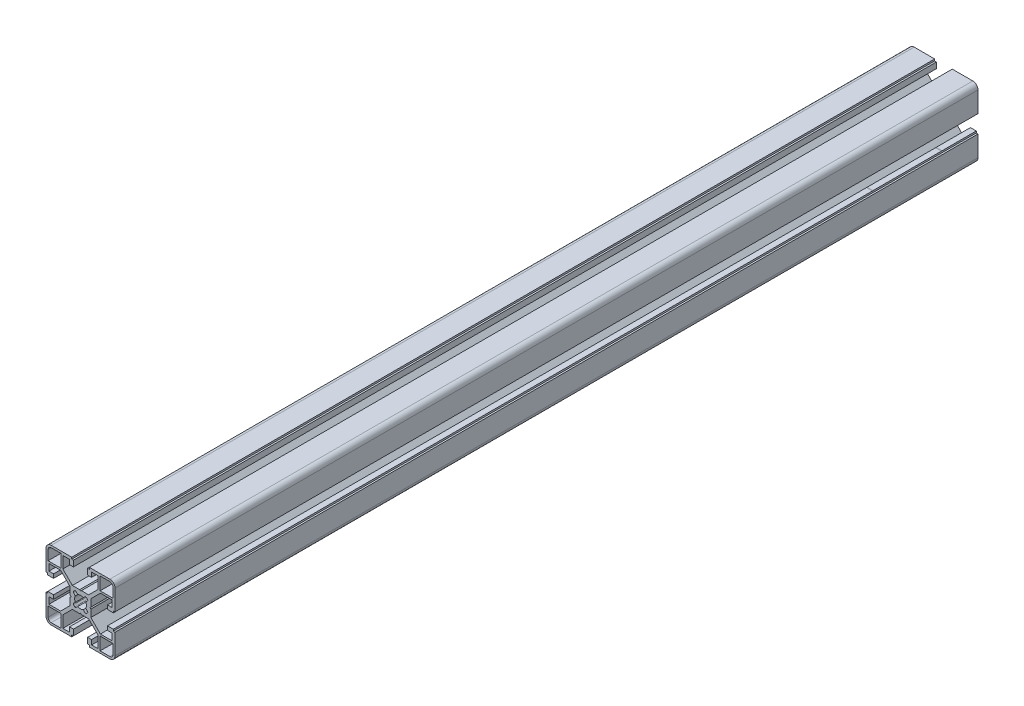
SolidWorks part; units mm, degrees
ref_plane "Спереди" through (0, 0, 0) normal (0, 0, 1) x (1, 0, 0)
ref_plane "Сверху" through (0, 0, 0) normal (0, 1, 0) x (1, 0, 0)
ref_plane "Справа" through (0, 0, 0) normal (1, 0, 0) x (0, 0, -1)
sketch "Эскиз1" plane through (0, 0, 0) normal (0, 0, 1) x (1, 0, 0)
  line L0 (2.2605, 2.8746) -> (1.1995, 1.8136)
  line L1 (-1.9819, 1.8136) -> (-3.0428, 2.8746)
  line L2 (-3.75, 2.8746) -> (-4.4571, 2.1675)
  line L3 (-4.4571, 1.4603) -> (-3.3961, 0.3994)
  line L4 (-3.3961, -2.782) -> (-4.4571, -3.843)
  line L5 (-4.4571, -4.5501) -> (-3.75, -5.2572)
  line L6 (-3.0428, -5.2572) -> (-1.9819, -4.1962)
  line L7 (1.1995, -4.1962) -> (2.2605, -5.2572)
  line L8 (2.9676, -5.2572) -> (3.6747, -4.5501)
  line L9 (3.6747, -3.843) -> (2.6137, -2.782)
  line L10 (2.6137, 0.3994) -> (3.6747, 1.4603)
  line L11 (3.6747, 2.1675) -> (2.9676, 2.8746)
  line L12 (10.9608, 17.6126) -> (10.9608, 10.1567)
  line L13 (10.9608, 10.1567) -> (18.4088, 10.1567)
  line L14 (18.4088, 10.1567) -> (18.4088, 15.8126)
  line L15 (16.6088, 17.6126) -> (10.9608, 17.6126)
  line L16 (-19.1912, 15.8126) -> (-19.1912, 10.1607)
  line L17 (-19.1912, 10.1607) -> (-11.7392, 10.1607)
  line L18 (-11.7392, 10.1607) -> (-11.7392, 17.6126)
  line L19 (-11.7412, -19.9874) -> (-11.7412, -12.5374)
  line L20 (-11.7412, -12.5374) -> (-19.1912, -12.5374)
  line L21 (-19.1912, -12.5374) -> (-19.1912, -18.1874)
  line L22 (-17.3912, -19.9874) -> (-11.7412, -19.9874)
  line L23 (18.4088, -12.5433) -> (10.9568, -12.5433)
  line L24 (10.9568, -12.5433) -> (10.9568, -19.9874)
  line L25 (10.9568, -19.9874) -> (16.6088, -19.9874)
  line L26 (18.4088, -18.1874) -> (18.4088, -12.5433)
  line L27 (-11.7392, 17.6126) -> (-17.3912, 17.6126)
  line L28 (-0.899, 4.8087) -> (-5.1283, 4.8087)
  line L29 (-5.1283, 4.8087) -> (-10.6438, 10.3271)
  line L30 (-10.6438, 10.3271) -> (-10.6438, 17.1126)
  line L31 (-10.6438, 17.1126) -> (-6.7958, 17.1126)
  line L32 (-6.7958, 17.1126) -> (-6.7958, 14.4126)
  line L33 (-6.7958, 14.4126) -> (-4.4958, 14.4126)
  line L34 (-4.4958, 14.4126) -> (-4.4958, 17.8126)
  line L35 (-4.4958, 17.8126) -> (-5.4958, 17.8126)
  line L36 (-5.4958, 17.8126) -> (-5.4958, 18.8126)
  line L37 (-5.4958, 18.8126) -> (-17.3958, 18.8126)
  line L38 (-20.3958, 15.8126) -> (-20.3958, 3.9126)
  line L39 (-20.3958, 3.9126) -> (-19.3958, 3.9126)
  line L40 (-19.3958, 3.9126) -> (-19.3958, 2.9126)
  line L41 (-19.3958, 2.9126) -> (-15.9958, 2.9126)
  line L42 (-15.9958, 2.9126) -> (-15.9958, 5.2053)
  line L43 (-15.9958, 5.2053) -> (-18.6958, 5.2053)
  line L44 (-18.6958, 5.2053) -> (-18.6958, 9.0533)
  line L45 (-18.6958, 9.0533) -> (-11.9226, 9.0533)
  line L46 (-11.9226, 9.0533) -> (-6.3958, 3.5271)
  line L47 (-6.3958, 3.5271) -> (-6.3958, -0.6905)
  line L48 (-6.3958, -0.6905) -> (-5.8949, -1.1914)
  line L49 (-5.8949, -1.1914) -> (-6.3958, -1.6923)
  line L50 (-6.3958, -1.6923) -> (-6.3958, -5.9099)
  line L51 (-6.3958, -5.9099) -> (-11.9233, -11.4374)
  line L52 (-11.9233, -11.4374) -> (-18.6958, -11.4374)
  line L53 (-18.6958, -11.4374) -> (-18.6958, -7.5874)
  line L54 (-18.6958, -7.5874) -> (-15.9958, -7.5874)
  line L55 (-15.9958, -7.5874) -> (-15.9958, -5.2874)
  line L56 (-15.9958, -5.2874) -> (-19.3958, -5.2874)
  line L57 (-19.3958, -5.2874) -> (-19.3958, -6.2874)
  line L58 (-19.3958, -6.2874) -> (-20.3958, -6.2874)
  line L59 (-20.3958, -6.2874) -> (-20.3958, -18.1874)
  line L60 (-17.3958, -21.1874) -> (-5.4958, -21.1874)
  line L61 (-5.4958, -21.1874) -> (-5.4958, -20.1874)
  line L62 (-5.4958, -20.1874) -> (-4.4958, -20.1874)
  line L63 (-4.4958, -20.1874) -> (-4.4958, -16.7874)
  line L64 (-4.4958, -16.7874) -> (-6.7958, -16.7874)
  line L65 (-6.7958, -16.7874) -> (-6.7958, -19.4874)
  line L66 (-6.7958, -19.4874) -> (-10.6458, -19.4874)
  line L67 (-10.6458, -19.4874) -> (-10.6458, -12.684)
  line L68 (-10.6458, -12.684) -> (-5.1336, -7.1913)
  line L69 (-5.1336, -7.1913) -> (-0.9023, -7.1913)
  line L70 (-0.9023, -7.1913) -> (-0.4037, -6.6927)
  line L71 (-0.4037, -6.6927) -> (0.0949, -7.1913)
  line L72 (0.0949, -7.1913) -> (4.3262, -7.1913)
  line L73 (4.3262, -7.1913) -> (9.8493, -12.7098)
  line L74 (9.8493, -12.7098) -> (9.8493, -19.4874)
  line L75 (9.8493, -19.4874) -> (6.0042, -19.4874)
  line L76 (6.0042, -19.4874) -> (6.0042, -16.7874)
  line L77 (6.0042, -16.7874) -> (3.7042, -16.7874)
  line L78 (3.7042, -16.7874) -> (3.7042, -20.1874)
  line L79 (3.7042, -20.1874) -> (4.7042, -20.1874)
  line L80 (4.7042, -20.1874) -> (4.7042, -21.1874)
  line L81 (4.7042, -21.1874) -> (16.6042, -21.1874)
  line L82 (19.6042, -18.1874) -> (19.6042, -6.2874)
  line L83 (19.6042, -6.2874) -> (18.599, -6.2874)
  line L84 (18.599, -6.2874) -> (18.599, -5.2874)
  line L85 (18.599, -5.2874) -> (15.199, -5.2874)
  line L86 (15.199, -5.2874) -> (15.199, -7.5874)
  line L87 (15.199, -7.5874) -> (17.899, -7.5874)
  line L88 (17.899, -7.5874) -> (17.899, -11.4433)
  line L89 (17.899, -11.4433) -> (11.1226, -11.4433)
  line L90 (11.1226, -11.4433) -> (5.599, -5.9193)
  line L91 (5.599, -5.9193) -> (5.599, -1.6815)
  line L92 (5.599, -1.6815) -> (5.1078, -1.1903)
  line L93 (5.1078, -1.1903) -> (5.599, -0.6991)
  line L94 (5.599, -0.6991) -> (5.599, 3.5388)
  line L95 (5.599, 3.5388) -> (11.1214, 9.0588)
  line L96 (11.1214, 9.0588) -> (17.899, 9.0588)
  line L97 (17.899, 9.0588) -> (17.899, 5.2147)
  line L98 (17.899, 5.2147) -> (15.199, 5.2147)
  line L99 (15.199, 5.2147) -> (15.199, 2.9147)
  line L100 (15.199, 2.9147) -> (18.599, 2.9147)
  line L101 (18.599, 2.9147) -> (18.599, 3.9147)
  line L102 (18.599, 3.9147) -> (19.6042, 3.9147)
  line L103 (19.6042, 3.9147) -> (19.6042, 15.8126)
  line L104 (16.6042, 18.8126) -> (4.7042, 18.8126)
  line L105 (4.7042, 18.8126) -> (4.7042, 17.8126)
  line L106 (4.7042, 17.8126) -> (3.7042, 17.8126)
  line L107 (3.7042, 17.8126) -> (3.7042, 14.4126)
  line L108 (3.7042, 14.4126) -> (6.0042, 14.4126)
  line L109 (6.0042, 14.4126) -> (6.0042, 17.1126)
  line L110 (6.0042, 17.1126) -> (9.8528, 17.1126)
  line L111 (9.8528, 17.1126) -> (9.8528, 10.3465)
  line L112 (9.8528, 10.3465) -> (4.3212, 4.8087)
  line L113 (4.3212, 4.8087) -> (0.0919, 4.8087)
  line L114 (0.0919, 4.8087) -> (-0.4035, 4.3133)
  line L115 (-0.4035, 4.3133) -> (-0.899, 4.8087)
  arc A0 (2.9676, 2.8746) -> (2.2605, 2.8746) centre (2.614, 2.521) ccw
  arc A1 (1.1995, 1.8136) -> (-1.9819, 1.8136) centre (-0.3912, -1.1913) ccw
  arc A2 (-3.0428, 2.8746) -> (-3.75, 2.8746) centre (-3.3964, 2.521) ccw
  arc A3 (-4.4571, 2.1675) -> (-4.4571, 1.4603) centre (-4.1035, 1.8139) ccw
  arc A4 (-3.3961, 0.3994) -> (-3.3961, -2.782) centre (-0.3912, -1.1913) ccw
  arc A5 (-4.4571, -3.843) -> (-4.4571, -4.5501) centre (-4.1035, -4.1965) ccw
  arc A6 (-3.75, -5.2572) -> (-3.0428, -5.2572) centre (-3.3964, -4.9036) ccw
  arc A7 (-1.9819, -4.1962) -> (1.1995, -4.1962) centre (-0.3912, -1.1913) ccw
  arc A8 (2.2605, -5.2572) -> (2.9676, -5.2572) centre (2.614, -4.9036) ccw
  arc A9 (3.6747, -4.5501) -> (3.6747, -3.843) centre (3.3211, -4.1965) ccw
  arc A10 (2.6137, -2.782) -> (2.6137, 0.3994) centre (-0.3912, -1.1913) ccw
  arc A11 (3.6747, 1.4603) -> (3.6747, 2.1675) centre (3.3211, 1.8139) ccw
  arc A12 (18.4088, 15.8126) -> (16.6088, 17.6126) centre (16.6088, 15.8126) ccw
  arc A13 (-17.3912, 17.6126) -> (-19.1912, 15.8126) centre (-17.3912, 15.8126) ccw
  arc A14 (-19.1912, -18.1874) -> (-17.3912, -19.9874) centre (-17.3912, -18.1874) ccw
  arc A15 (16.6088, -19.9874) -> (18.4088, -18.1874) centre (16.6088, -18.1874) ccw
  arc A16 (-17.3958, 18.8126) -> (-20.3958, 15.8126) centre (-17.3958, 15.8126) ccw
  arc A17 (-20.3958, -18.1874) -> (-17.3958, -21.1874) centre (-17.3958, -18.1874) ccw
  arc A18 (16.6042, -21.1874) -> (19.6042, -18.1874) centre (16.6042, -18.1874) ccw
  arc A19 (19.6042, 15.8126) -> (16.6042, 18.8126) centre (16.6042, 15.8126) ccw
extrude "Бобышка-Вытянуть1" add sketch "Эскиз1" along normal blind 500
hole_wizard "Диаметр отверстия Ø8.2 (8.2)2" positions "Эскиз4" profile "Эскиз5" hole size "Ø8.2" standard "ISO"
sketch "Эскиз4" plane through (-6.3958, 0, 0) normal (-1, 0, 0) x (0, 0, 1)
  line L0 (500, -1.1914) -> (0, -1.1914) construction
  line L1 (0, -1.6923) -> (0, -5.9099) construction
  point P0 (20, -1.1914)
  point P2 (60, -1.1914)
  dimension "D1" = 20
  dimension "D2" = 40
sketch "Эскиз5" plane through (-6.3958, -1.1914, 20) normal (0, 1, 0) x (0, 0, 1)
  line L0 (0, 0) -> (0, 28.6635)
  line L1 (0, 28.6635) -> (4.1, 26.2)
  line L2 (4.1, 26.2) -> (4.1, 0)
  line L5 (4.1, 0) -> (0, 0)
  line L10 (0, 28.6635) -> (-4.1, 26.2) construction
  line L11 (0, -6.35) -> (0, 107.95) construction
  dimension "Диаметр отверстия" = 8.2
  dimension "Глубина отверстия" = 26.2
  dimension "Угол заточки сверла" = 118
hole_wizard "Диаметр отверстия Ø8.2 (8.2)3" positions "Эскиз6" profile "Эскиз7" hole size "Ø8.2" standard "ISO"
sketch "Эскиз6" plane through (0, 4.8087, 0) normal (0, 1, 0) x (1, 0, 0)
  line L0 (-0.4035, -1570) -> (-0.4035, 0) construction
  line L1 (4.3212, 0) -> (0.0919, 0) construction
  point P0 (-0.4035, -20)
  point P13 (-0.4035, -530)
  point P14 (-0.4035, -1040)
  dimension "D1" = 20
  dimension "D2" = 3
sketch "Эскиз7" plane through (-0.4035, 4.8087, 20) normal (1, 0, 0) x (0, 0, 1)
  line L0 (0, 0) -> (0, 28.6635)
  line L1 (0, 28.6635) -> (4.1, 26.2)
  line L2 (4.1, 26.2) -> (4.1, 0)
  line L5 (4.1, 0) -> (0, 0)
  line L10 (0, 28.6635) -> (-4.1, 26.2) construction
  line L11 (0, -6.35) -> (0, 107.95) construction
  dimension "Диаметр отверстия" = 8.2
  dimension "Глубина отверстия" = 26.2
  dimension "Угол заточки сверла" = 118
hole_wizard "Диаметр отверстия Ø8.2 (8.2)4" positions "Эскиз8" profile "Эскиз9" hole size "Ø8.2" standard "ISO"
sketch "Эскиз8" plane through (0, -7.1913, 0) normal (0, -1, 0) x (-1, 0, 0)
  line L1 (0.4037, -1128.01) -> (0.4037, 0) construction
  line L2 (-0.0949, 0) -> (-4.3262, 0) construction
  point P0 (0.4037, -58)
  point P15 (0.4037, -738)
  dimension "D1" = 58
  dimension "D2" = 2
sketch "Эскиз9" plane through (-0.4037, -7.1913, 58) normal (1, 0, 0) x (0, 0, -1)
  line L0 (0, 0) -> (0, 28.6635)
  line L1 (0, 28.6635) -> (4.1, 26.2)
  line L2 (4.1, 26.2) -> (4.1, 0)
  line L5 (4.1, 0) -> (0, 0)
  line L10 (0, 28.6635) -> (-4.1, 26.2) construction
  line L11 (0, -6.35) -> (0, 107.95) construction
  dimension "Диаметр отверстия" = 8.2
  dimension "Глубина отверстия" = 26.2
  dimension "Угол заточки сверла" = 118
hole_wizard "Диаметр отверстия Ø8.2 (8.2)5" positions "Эскиз10" profile "Эскиз11" hole size "Ø8.2" standard "ISO"
sketch "Эскиз10" plane through (-6.3958, 0, 0) normal (-1, 0, 0) x (0, 0, 1)
  line L0 (1148.01, -1.1914) -> (0, -1.1914) construction
  line L1 (0, -1.6923) -> (0, -5.9099) construction
  point P0 (18, -1.1914)
  dimension "D1" = 18
sketch "Эскиз11" plane through (-6.3958, -1.1914, 18) normal (0, 1, 0) x (0, 0, 1)
  line L0 (0, 0) -> (0, 58.6635)
  line L1 (0, 58.6635) -> (4.1, 56.2)
  line L2 (4.1, 56.2) -> (4.1, 0)
  line L5 (4.1, 0) -> (0, 0)
  line L10 (0, 58.6635) -> (-4.1, 56.2) construction
  line L11 (0, -6.35) -> (0, 107.95) construction
  dimension "Диаметр отверстия" = 8.2
  dimension "Глубина отверстия" = 56.2
  dimension "Угол заточки сверла" = 118
